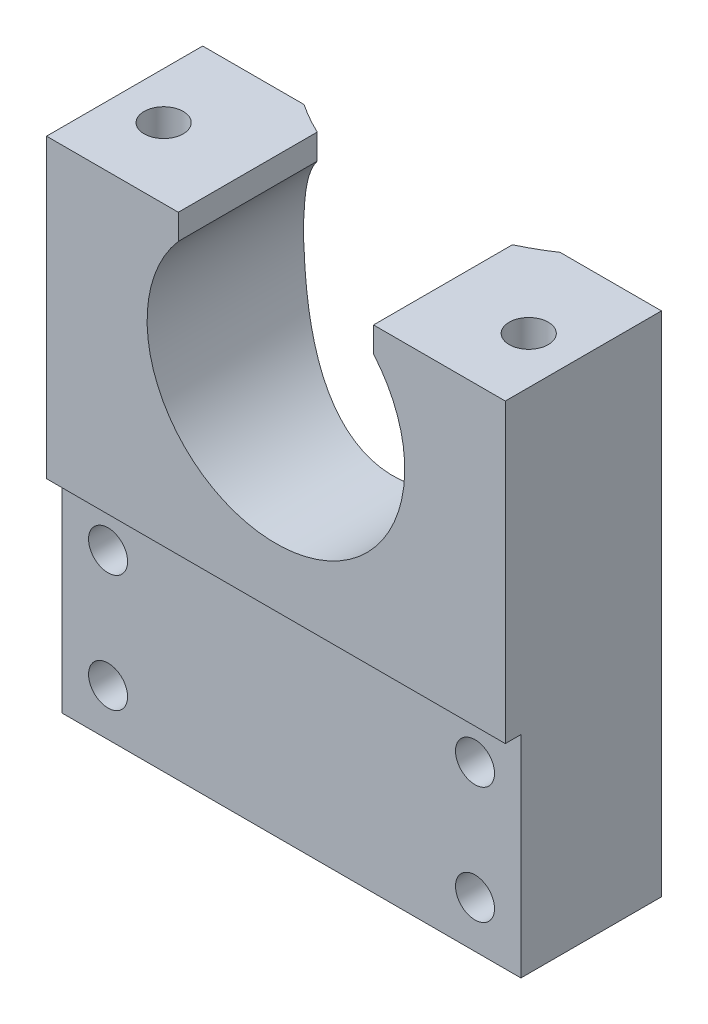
SolidWorks part; units mm, degrees
ref_plane "Front Plane" through (0, 0, 0) normal (0, 0, 1) x (1, 0, 0)
ref_plane "Top Plane" through (0, 0, 0) normal (0, 1, 0) x (1, 0, 0)
ref_plane "Right Plane" through (0, 0, 0) normal (1, 0, 0) x (0, 0, -1)
sketch "Sketch1" plane through (0, 0, 0) normal (0, 1, 0) x (1, 0, 0)
  line L0 (0, 0) -> (0, 44.2963) construction
  line L1 (37.3126, 0) -> (-37.3126, 0)
  line L2 (-37.3126, 0) -> (-37.3126, 56.3626)
  line L3 (37.3126, 0) -> (37.3126, 56.3626)
  arc A0 (-37.3126, 56.3626) -> (37.3126, 56.3626) centre (0, 56.3626) ccw
  dimension "D1" = 37.3126
  dimension "D3" = 19.05
  dimension "D2" = 74.6252
extrude "Boss-Extrude1" add sketch "Sketch1" along normal blind 82.55
sketch "Sketch2" plane through (0, 82.55, 0) normal (0, 1, 0) x (1, 0, 0)
  line L0 (0, 0) -> (0, 25.4) construction
  line L1 (-44.45, 71.12) -> (44.45, 71.12)
  line L2 (-44.45, 71.12) -> (-44.45, 25.4)
  line L3 (-44.45, 25.4) -> (44.45, 25.4)
  line L4 (44.45, 71.12) -> (44.45, 25.4)
  line L5 (-37.3126, 0) -> (37.3126, 0) construction
  dimension "D1" = 25.4
  dimension "D2" = 88.9
  dimension "D3" = 45.72
extrude "Cut-Extrude1" cut sketch "Sketch2" against normal through all
sketch "Sketch4" plane through (0, 0, 0) normal (0, 0, 1) x (1, 0, 0)
  line L0 (0, 82.55) -> (0, 64.77) construction
  line L1 (-37.3126, 82.55) -> (37.3126, 82.55) construction
  line L3 (-15.875, 78.4483) -> (-15.875, 82.55)
  line L4 (-15.875, 82.55) -> (15.875, 82.55)
  line L5 (15.875, 82.55) -> (15.875, 78.4483)
  arc A0 (-15.875, 78.4483) -> (15.875, 78.4483) centre (0, 64.77) ccw
  dimension "D2" = 41.91
  dimension "D1" = 17.78
  dimension "D3" = 31.75
extrude "Cut-Extrude3" cut sketch "Sketch4" against normal through all
sketch "Sketch6" plane through (0, 0, 0) normal (0, 0, 1) x (1, 0, 0)
  line L0 (37.3126, 82.55) -> (37.3126, 0) construction
  line L1 (-37.3126, 0) -> (37.3126, 0)
  line L2 (-37.3126, 0) -> (-37.3126, 34.29)
  line L3 (-37.3126, 34.29) -> (37.3126, 34.29)
  line L4 (37.3126, 0) -> (37.3126, 34.29)
  dimension "D1" = 34.29
extrude "Cut-Extrude4" cut sketch "Sketch6" against normal blind 2.54
hole_wizard "1/4-20 Tapped Hole1" positions "Sketch8" profile "Sketch7" tap size "1/4-20" standard "Ansi Inch"
sketch "Sketch8" plane through (0, 0, -2.54) normal (0, 0, 1) x (1, 0, 0)
  line L0 (0, 0) -> (0, 32.1442) construction
  line L2 (-37.465, 17.145) -> (0, 17.145) construction
  line L6 (37.3126, 34.29) -> (-37.3126, 34.29) construction
  point P0 (-29.845, 26.67)
  point P12 (-29.845, 7.62)
  point P13 (29.845, 7.62)
  point P14 (29.845, 26.67)
  dimension "D1" = 59.69
  dimension "D2" = 19.05
  dimension "D3" = 7.62
sketch "Sketch7" plane through (-29.845, 26.67, -2.54) normal (1, 0, 0) x (0, -1, 0)
  line L0 (0, 0) -> (0, 24.3242)
  line L1 (0, 24.3242) -> (3.175, 24.3242)
  line L2 (3.175, 24.3242) -> (3.175, 0)
  line L5 (3.175, 0) -> (0, 0)
  line L11 (0, -6.35) -> (0, 107.95) construction
  dimension "Thread Major Dia." = 6.35
  dimension "Thru Tap Drill Depth" = 24.3242
hole_wizard "1/4-20 Tapped Hole2" positions "Sketch10" profile "Sketch9" tap size "1/4-20" standard "Ansi Inch"
sketch "Sketch10" plane through (0, 82.55, 0) normal (0, 1, 0) x (-1, 0, 0)
  line L0 (0, 0) -> (0, -34.7347) construction
  line L2 (37.3126, -25.4) -> (37.3126, 0) construction
  line L3 (37.3126, 0) -> (15.875, 0) construction
  point P0 (29.6926, -11.43)
  point P11 (-29.6926, -11.43)
  dimension "D1" = 7.62
  dimension "D2" = 11.43
sketch "Sketch9" plane through (-29.6926, 82.55, -11.43) normal (1, 0, 0) x (0, 0, 1)
  line L0 (0, 0) -> (0, 33.2838)
  line L1 (0, 33.2838) -> (2.5527, 31.75)
  line L2 (2.5527, 31.75) -> (2.5527, 25.4)
  line L3 (2.5527, 25.4) -> (3.175, 25.4)
  line L4 (3.175, 25.4) -> (3.175, 0)
  line L5 (3.175, 0) -> (0, 0)
  line L10 (0, 33.2838) -> (-2.5527, 31.75) construction
  line L11 (0, -6.35) -> (0, 107.95) construction
  dimension "Tap Drill Dia." = 5.1054
  dimension "Tap Drill Depth" = 31.75
  dimension "Thread Major Dia." = 6.35
  dimension "Thread Depth" = 25.4
  dimension "Drill Angle" = 118
equation "\"Buoyancy\"=\"SW-Volume\"*(\"SW-Density\"-.037062)"
